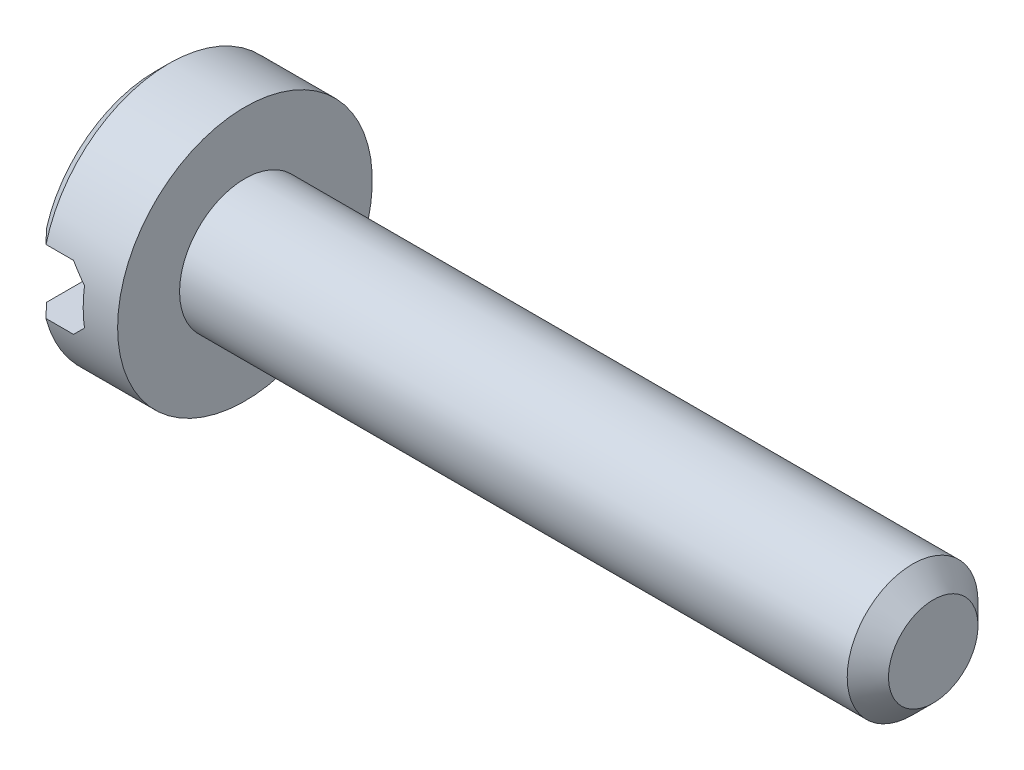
SolidWorks part; units mm, degrees
ref_plane "Face" through (0, 0, 0) normal (0, 0, 1) x (1, 0, 0)
ref_plane "Dessus" through (0, 0, 0) normal (0, 1, 0) x (1, 0, 0)
ref_plane "Droite" through (0, 0, 0) normal (1, 0, 0) x (0, 0, -1)
sketch "Esquisse1" plane through (0, 0, 0) normal (0, 0, 1) x (1, 0, 0)
  line L0 (0, 0) -> (0, 1.65)
  line L1 (0.2, 1.85) -> (1.3, 1.85)
  line L2 (1.3, 1.85) -> (1.3, 0)
  line L5 (0, 0) -> (7.6423, 0) construction
  line L7 (0, 1.65) -> (0.2, 1.85)
  line L8 (0, 0) -> (1.3, 0)
  point P1 (0, 1.85)
  dimension "D1" = 1.85
  dimension "D3" = 1.3
revolve "Révolution1" add sketch "Esquisse1" angle 360 about L5
sketch "Esquisse2" plane through (0, 0, 0) normal (0, 0, 1) x (1, 0, 0)
  line L0 (0, 1.65) -> (0, -1.65) construction
  line L1 (0, 0.4655) -> (0.6, 0.4655)
  line L2 (0, 0.4655) -> (0, -0.4655)
  line L3 (0, -0.4655) -> (0.6, -0.4655)
  line L4 (0.8, 0.2655) -> (0.8, -0.2655)
  line L5 (0.6, 0.4655) -> (0.8, 0.2655)
  line L6 (0.6, -0.4655) -> (0.8, -0.2655)
  point P1 (0.8, -0.4655)
  point P3 (0.8, 0.4655)
extrude "Enlèv. mat.-Extru.1" cut sketch "Esquisse2" against normal mid plane 10
sketch "Esquisse3" plane through (1.3, 0, 0) normal (1, 0, 0) x (0, 0, -1)
  circle A0 centre (0, 0) radius 0.95
extrude "Extrusion1" add sketch "Esquisse3" along normal blind 10
chamfer "Chanfrein1" distance 0.3 angle 45 1 edges at (11.3, 0, -0.95)
